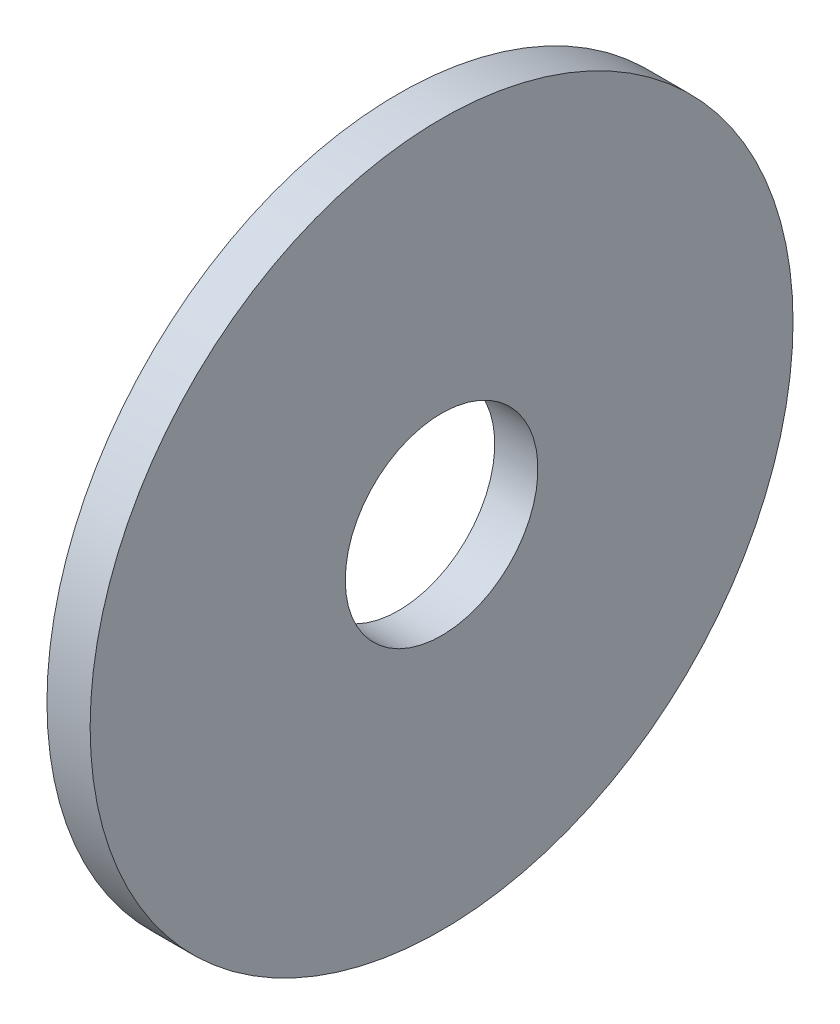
SolidWorks part; units mm, degrees
ref_plane "Plane1" through (0, 0, 0) normal (0, 0, 1) x (1, 0, 0)
ref_plane "Plane2" through (0, 0, 0) normal (0, 1, 0) x (1, 0, 0)
ref_plane "Plane3" through (0, 0, 0) normal (1, 0, 0) x (0, 0, -1)
other "Configuration Table"
sketch "Sketch1" plane through (0, 0, 0) normal (0, 0, 1) x (1, 0, 0)
  line L0 (-34.925, 0) -> (9.525, 0) construction
  line L1 (0, 13.4874) -> (0, 49.2125)
  line L2 (0, 49.2125) -> (-6.0452, 49.2125)
  line L3 (-6.0452, 49.2125) -> (-6.0452, 13.4874)
  line L4 (-6.0452, 13.4874) -> (0, 13.4874)
  dimension "Thickness" = 6.0452
  dimension "Inside_dia" = 26.9748
  dimension "Outside_dia" = 98.425
revolve "Base-Revolve" add sketch "Sketch1" angle 360 about L0
